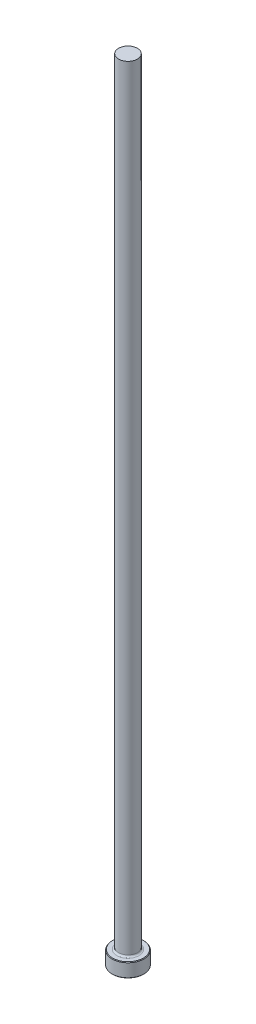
SolidWorks part; units mm, degrees
ref_plane "Front Plane" through (0, 0, 0) normal (0, 0, 1) x (1, 0, 0)
ref_plane "Top Plane" through (0, 0, 0) normal (0, 1, 0) x (1, 0, 0)
ref_plane "Right Plane" through (0, 0, 0) normal (1, 0, 0) x (0, 0, -1)
sketch "Sketch1" plane through (0, 0, 0) normal (0, 0, 1) x (1, 0, 0)
  line L0 (0, 259.9588) -> (0, -15.1925) construction
  line L1 (0, 0) -> (-7.1374, 0)
  line L2 (-7.1374, 0) -> (-7.1374, 6.35)
  line L3 (-7.1374, 6.35) -> (-4.2304, 6.35)
  line L4 (-4.2304, 6.35) -> (-4.2304, 355.6)
  line L5 (-4.2304, 355.6) -> (0, 355.6)
  line L6 (0, 355.6) -> (0, 0)
  dimension "L" = 355.6
  dimension "H" = 14.2748
  dimension "T" = 6.35
  dimension "D" = 8.4607
revolve "Revolve1" add sketch "Sketch1" angle 360 about L0
chamfer "Chamfer1" distance 0.254 angle 45 2 edges at (0, 6.35, 7.1374) (0, 0, 7.1374)
fillet "Fillet1" radius 0.762 1 edges at (0, 6.35, 4.2304)
sketch "Pocket Sketch" plane through (0, 0, 0) normal (0, 0, 1) x (1, 0, 0)
  line L0 (-7.5343, 0) -> (-7.5343, 6.3754)
  line L1 (-7.5343, 6.3754) -> (-5.3892, 6.3754)
  line L2 (-4.6272, 7.1374) -> (-4.6272, 22.225)
  line L3 (-4.6272, 22.225) -> (0, 22.225)
  line L4 (0, 22.225) -> (0, 0)
  line L5 (0, 0) -> (-7.5343, 0)
  line L6 (0, 12.6104) -> (0, -2.4989) construction
  line L7 (-7.1374, 6.096) -> (-7.1374, 0.254) construction
  line L8 (6.8834, 6.35) -> (-6.8834, 6.35) construction
  line L9 (-4.2304, 355.6) -> (-4.2304, 7.112) construction
  line L10 (-5.3892, 6.3754) -> (-4.6272, 7.1374)
  point P3 (-4.6272, 6.3754)
  dimension "D1" = 15.0685
  dimension "D2" = 0.3969
  dimension "D3" = 0.0254
  dimension "D4" = 0.3969
  dimension "D5" = 9.2545
  dimension "D6" = 22.225
